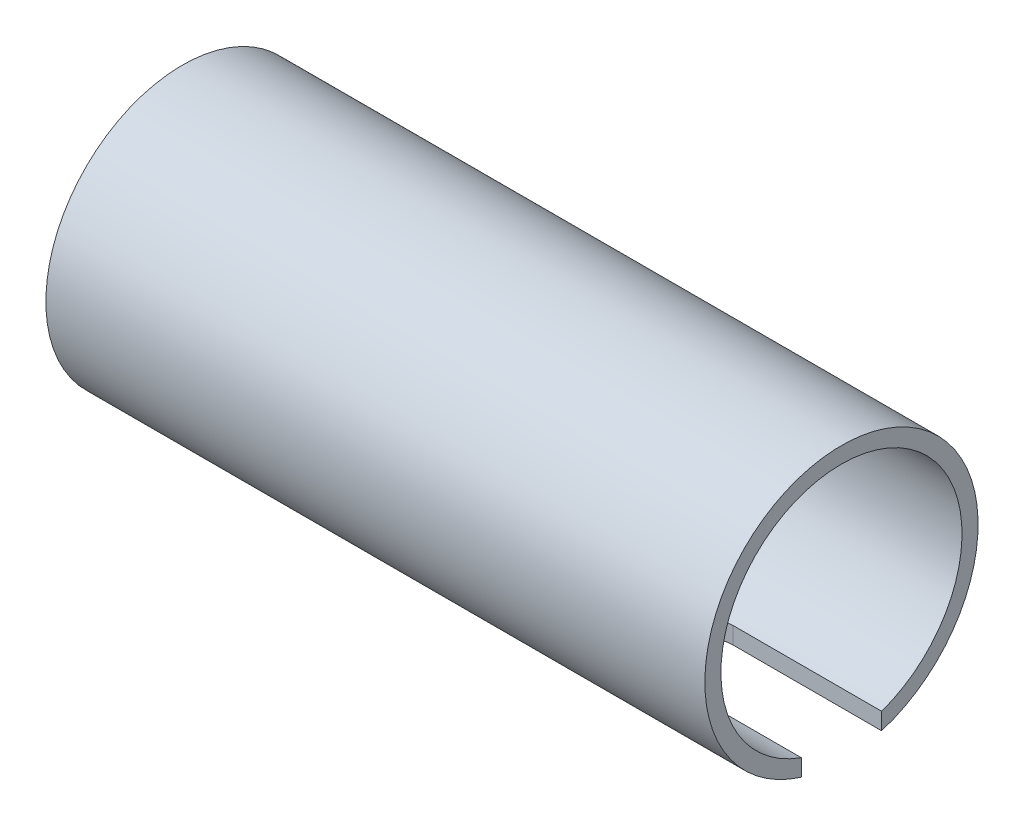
SolidWorks part; units mm, degrees
ref_plane "Plan de face" through (0, 0, 0) normal (0, 0, 1) x (1, 0, 0)
ref_plane "Plan de dessus" through (0, 0, 0) normal (0, 1, 0) x (1, 0, 0)
ref_plane "Plan de droite" through (0, 0, 0) normal (1, 0, 0) x (0, 0, -1)
sketch "Esquisse1" plane through (0, 0, 0) normal (1, 0, 0) x (0, 0, -1)
  circle A0 centre (0, 0) radius 7.5
  circle A1 centre (0, 0) radius 8.5
  dimension "D1" = 15
  dimension "D2" = 17
extrude "Boss.-Extru.1" add sketch "Esquisse1" along normal blind 41
ref_plane "Plan1" through (20.5, 0, 0) normal (1, 0, 0) x (0, 0, -1)
sketch "Esquisse2" plane through (0, 0, 0) normal (0, 1, 0) x (1, 0, 0)
  line L0 (46.0294, 0) -> (31.7451, 0) construction
  line L1 (46.0294, -2.5) -> (31.7451, -2.5)
  line L2 (46.0294, 2.5) -> (31.7451, 2.5)
  arc A0 (46.0294, -2.5) -> (46.0294, 2.5) centre (46.0294, 0) ccw
  arc A1 (31.7451, 2.5) -> (31.7451, -2.5) centre (31.7451, 0) ccw
  point P3 (38.8872, 0)
  dimension "D1" = 5
  dimension "D2" = 14.2843
extrude "Enlèv. mat.-Extru.1" cut sketch "Esquisse2" against normal blind 10
